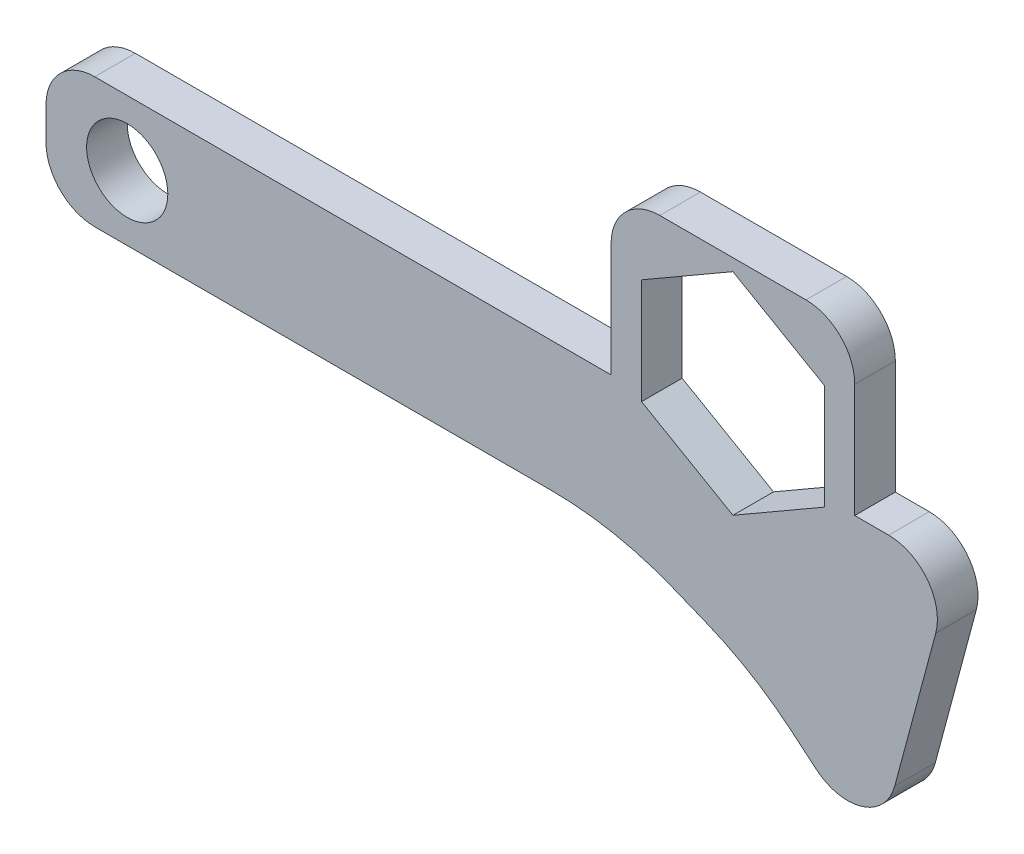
SolidWorks part; units mm, degrees
ref_plane "Front Plane" through (0, 0, 0) normal (0, 0, 1) x (1, 0, 0)
ref_plane "Top Plane" through (0, 0, 0) normal (0, 1, 0) x (1, 0, 0)
ref_plane "Right Plane" through (0, 0, 0) normal (1, 0, 0) x (0, 0, -1)
sketch "Sketch1" plane through (0, 0, 0) normal (0, 0, 1) x (1, 0, 0)
  line L0 (64.8174, -12.377) -> (55.2832, -4.3769)
  line L1 (0, 0) -> (44.45, 0)
  line L2 (0, 0) -> (0, 10.16)
  line L3 (0, 10.16) -> (70.8562, 10.16)
  line L4 (64.8174, -12.377) -> (70.8562, 10.16)
  line L5 (44.45, 0) -> (55.2832, -4.3769)
  circle A0 centre (6.35, 5.08) radius 3.175
  point P7 (0, 5.08)
  dimension "D1" = 6.35
  dimension "D2" = 10.16
  dimension "D3" = 6.35
  dimension "D4" = 158
  dimension "D5" = 65
  dimension "D6" = 162
  dimension "D7" = 11.684
  dimension "D8" = 44.45
  dimension "D9" = 12.446
extrude "Boss-Extrude1" add sketch "Sketch1" along normal blind 3.175
sketch "Sketch7" plane through (0, 0, 0) normal (0, 0, 1) x (1, 0, 0)
  line L0 (70.8562, 10.16) -> (0, 10.16) construction
  line L1 (44.1862, 10.16) -> (63.2362, 10.16)
  line L2 (44.1862, 10.16) -> (44.1862, 22.86)
  line L3 (44.1862, 22.86) -> (63.2362, 22.86)
  line L4 (63.2362, 10.16) -> (63.2362, 22.86)
  dimension "D1" = 12.7
  dimension "D2" = 19.05
  dimension "D3" = 7.62
extrude "Boss-Extrude2" add sketch "Sketch7" along normal blind 3.175
fillet "Fillet1" radius 3.81 6 edges at (70.8562, 10.16, 1.5875) (0, 0, 1.5875) (0, 10.16, 1.5875) (64.8174, -12.377, 1.5875) (63.2362, 22.86, 1.5875) (44.1862, 22.86, 1.5875)
fillet "Fillet2" radius 25.4 2 edges at (44.45, 0, 1.5875) (55.2832, -4.3769, 1.5875)
hole_wizard "#4 Clearance Hole1" positions "Sketch6" profile "Sketch5" hole size "#4" standard "ANSI Inch"
sketch "Sketch6" plane through (0, 0, 3.175) normal (0, 0, 1) x (1, 0, 0)
  point P0 (66.0783, 14.4613)
sketch "Sketch5" plane through (66.0783, 14.4613, 3.175) normal (1, 0, 0) x (0, -1, 0)
  line L0 (0, 0) -> (0, 3.175)
  line L1 (0, 3.175) -> (1.4732, 3.175)
  line L2 (1.4732, 3.175) -> (1.4732, 0)
  line L5 (1.4732, 0) -> (0, 0)
  line L11 (0, -6.35) -> (0, 107.95) construction
  dimension "Thru Hole Dia." = 2.9464
  dimension "Thru Hole Depth" = 3.175
sketch "Sketch8" plane through (0, 0, 3.175) normal (0, 0, 1) x (1, 0, 0)
  line L0 (59.4262, 22.86) -> (47.9962, 22.86) construction
  line L1 (60.8549, 17.7879) -> (53.7112, 21.9123)
  line L2 (53.7112, 21.9123) -> (46.5674, 17.7879)
  line L3 (46.5674, 17.7879) -> (46.5674, 9.539)
  line L4 (46.5674, 9.539) -> (53.7112, 5.4145)
  line L5 (53.7112, 5.4145) -> (60.8549, 9.539)
  line L6 (60.8549, 9.539) -> (60.8549, 17.7879)
  circle A0 centre (53.7112, 13.6634) radius 7.1437 construction
  point P10 (53.7112, 22.86)
  dimension "D1" = 14.2875
extrude "Cut-Extrude1" cut sketch "Sketch8" against normal blind 3.175
